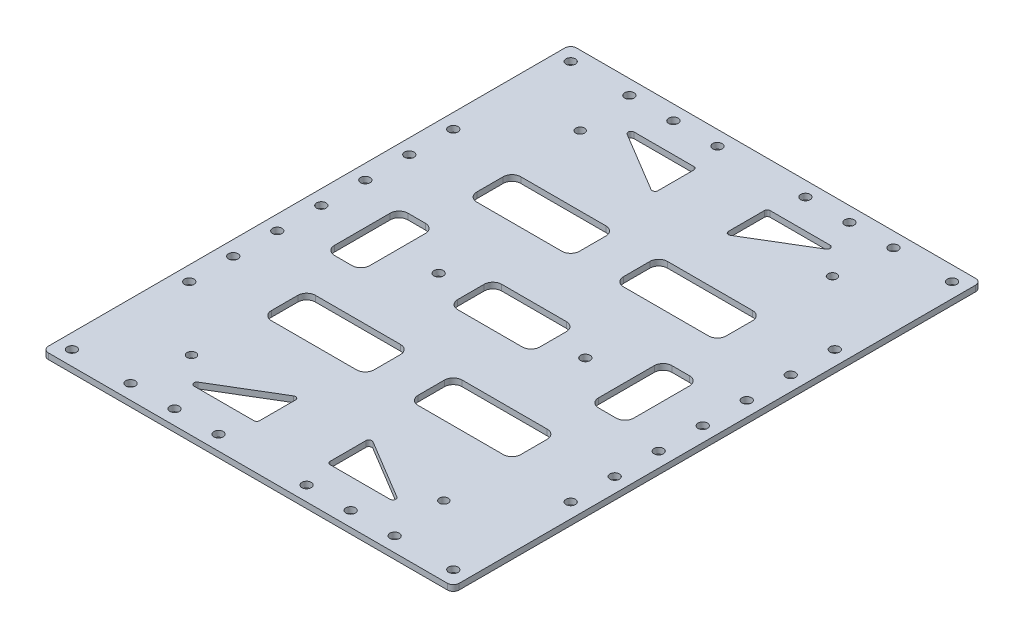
SolidWorks part; units mm, degrees
ref_plane "前视基准面" through (0, 0, 0) normal (0, 0, 1) x (1, 0, 0)
ref_plane "上视基准面" through (0, 0, 0) normal (0, 1, 0) x (1, 0, 0)
ref_plane "右视基准面" through (0, 0, 0) normal (1, 0, 0) x (0, 0, -1)
other "Configuration Table"
sketch "草图1" plane through (0, 0, 0) normal (0, 1, 0) x (1, 0, 0)
  line L1 (-90, -90) -> (90, -90)
  line L2 (-90, -90) -> (-90, 90)
  line L3 (-90, 90) -> (90, 90)
  line L4 (90, -90) -> (90, 90)
  line L5 (-90, -90) -> (90, 90) construction
  line L6 (-90, 90) -> (90, -90) construction
  point P0 (0, 0)
  dimension "D1" = 180
  dimension "D2" = 180
extrude "凸台-拉伸1" add sketch "草图1" along normal blind 2
sketch "草图2" plane through (0, 2, 0) normal (0, 1, 0) x (1, 0, 0)
  line L1 (-42.9895, -66.2305) -> (42.9895, -66.2305) construction
  line L2 (-42.9895, -66.2305) -> (-42.9895, 66.2305) construction
  line L3 (-42.9895, 66.2305) -> (42.9895, 66.2305) construction
  line L4 (42.9895, -66.2305) -> (42.9895, 66.2305) construction
  line L5 (-42.9895, -66.2305) -> (42.9895, 66.2305) construction
  line L6 (-42.9895, 66.2305) -> (42.9895, -66.2305) construction
  circle A0 centre (-42.9895, 66.2305) radius 1.5
  circle A1 centre (42.9895, 66.2305) radius 1.5
  circle A2 centre (-42.9895, -66.2305) radius 1.5
  circle A3 centre (42.9895, -66.2305) radius 1.5
  point P0 (0, 0)
  dimension "D3" = 3
  dimension "D1" = 132.461
  dimension "D2" = 85.979
extrude "切除-拉伸1" cut sketch "草图2" against normal blind 3
sketch "草图3" plane through (0, 2, 0) normal (0, 1, 0) x (1, 0, 0)
  line L0 (-90, 0) -> (90, 0) construction
  line L1 (-14, -7.5) -> (14, -7.5)
  line L2 (-14, -7.5) -> (-14, 7.5)
  line L3 (-14, 7.5) -> (14, 7.5)
  line L4 (14, -7.5) -> (14, 7.5)
  line L5 (-14, -7.5) -> (14, 7.5) construction
  line L6 (-14, 7.5) -> (14, -7.5) construction
  line L7 (-90, 90) -> (-90, -90) construction
  line L8 (90, -90) -> (90, 90) construction
  line L9 (0, 90) -> (0, -90) construction
  line L10 (90, 90) -> (-90, 90) construction
  line L11 (-90, -90) -> (90, -90) construction
  line L12 (-25, 35) -> (0, 35) construction
  line L13 (-42.5, 27.5) -> (-7.5, 27.5)
  line L14 (-42.5, 27.5) -> (-42.5, 42.5)
  line L15 (-42.5, 42.5) -> (-7.5, 42.5)
  line L16 (-7.5, 27.5) -> (-7.5, 42.5)
  line L17 (-42.5, 27.5) -> (-7.5, 42.5) construction
  line L18 (-42.5, 42.5) -> (-7.5, 27.5) construction
  line L23 (42.5, 42.5) -> (7.5, 42.5)
  line L24 (7.5, 27.5) -> (7.5, 42.5)
  line L25 (-25, 35) -> (-25, 0) construction
  line L26 (42.5, 27.5) -> (7.5, 27.5)
  line L27 (42.5, 27.5) -> (42.5, 42.5)
  line L28 (51, 12.5) -> (39, 12.5)
  line L29 (-51, -12.5) -> (-39, -12.5)
  line L30 (-51, -12.5) -> (-51, 12.5)
  line L31 (-51, 12.5) -> (-39, 12.5)
  line L32 (-39, -12.5) -> (-39, 12.5)
  line L33 (-51, -12.5) -> (-39, 12.5) construction
  line L34 (-51, 12.5) -> (-39, -12.5) construction
  line L35 (51, -12.5) -> (39, -12.5)
  line L36 (51, -12.5) -> (51, 12.5)
  line L37 (39, -12.5) -> (39, 12.5)
  line L38 (-42.5, -42.5) -> (-7.5, -42.5)
  line L39 (-7.5, -27.5) -> (-7.5, -42.5)
  line L40 (-42.5, -27.5) -> (-7.5, -27.5)
  line L41 (-42.5, -27.5) -> (-42.5, -42.5)
  line L42 (42.5, -27.5) -> (42.5, -42.5)
  line L43 (42.5, -27.5) -> (7.5, -27.5)
  line L44 (7.5, -27.5) -> (7.5, -42.5)
  line L45 (42.5, -42.5) -> (7.5, -42.5)
  line L51 (-37, 75) -> (-12, 75)
  line L52 (-12, 75) -> (-12, 60)
  line L56 (-12, 60) -> (-37, 75)
  line L57 (12, 75) -> (12, 60)
  line L58 (37, 75) -> (12, 75)
  line L59 (12, 60) -> (37, 75)
  line L60 (37, -75) -> (12, -75)
  line L61 (12, -60) -> (37, -75)
  line L62 (12, -75) -> (12, -60)
  line L63 (-12, -75) -> (-12, -60)
  line L64 (-37, -75) -> (-12, -75)
  line L65 (-12, -60) -> (-37, -75)
  point P0 (0, 0)
  point P18 (-25, 35)
  point P27 (-45, 0)
  dimension "D1" = 28
  dimension "D2" = 15
  dimension "D3" = 35
  dimension "D4" = 25
  dimension "D5" = 35
  dimension "D6" = 15
  dimension "D7" = 45
  dimension "D8" = 12
  dimension "D9" = 25
  dimension "D10" = 15
  dimension "D11" = 15
  dimension "D12" = 12
  dimension "D13" = 25
extrude "切除-拉伸2" cut sketch "草图3" against normal blind 3
fillet "圆角1" radius 3 4 edges at (-14, 1, 7.5) (14, 1, 7.5) (14, 1, -7.5) (-14, 1, -7.5)
sketch "草图5" plane through (0, 2, 0) normal (0, 1, 0) x (1, 0, 0)
  line L0 (80, 90) -> (90, 80)
  line L1 (-77.5, -77.5) -> (77.5, -77.5) construction
  line L2 (-77.5, -77.5) -> (-77.5, 77.5) construction
  line L3 (-77.5, 77.5) -> (77.5, 77.5) construction
  line L4 (77.5, -77.5) -> (77.5, 77.5) construction
  line L5 (-77.5, -77.5) -> (77.5, 77.5) construction
  line L6 (-77.5, 77.5) -> (77.5, -77.5) construction
  line L7 (69.0147, 77.5) -> (77.5, 69.0147) construction
  line L8 (69.0147, 77.5) -> (77.5, 85.9853) construction
  line L9 (77.5, 85.9853) -> (85.9853, 77.5) construction
  line L10 (77.5, 69.0147) -> (85.9853, 77.5) construction
  line L11 (69.0147, 77.5) -> (85.9853, 77.5) construction
  line L12 (77.5, 85.9853) -> (77.5, 69.0147) construction
  line L13 (90, 90) -> (-90, 90) construction
  line L14 (90, -90) -> (90, 90) construction
  line L24 (90, 80) -> (90, 90)
  line L25 (90, 90) -> (80, 90)
  line L26 (0, 90) -> (0, -90) construction
  line L27 (-90, -90) -> (90, -90) construction
  line L28 (90, 0) -> (-90, 0) construction
  line L29 (-90, 90) -> (-90, -90) construction
  line L30 (-77.5, 85.9853) -> (-77.5, 69.0147) construction
  line L31 (-69.0147, 77.5) -> (-85.9853, 77.5) construction
  line L32 (-77.5, 69.0147) -> (-85.9853, 77.5) construction
  line L33 (-77.5, 85.9853) -> (-85.9853, 77.5) construction
  line L34 (-69.0147, 77.5) -> (-77.5, 85.9853) construction
  line L35 (-69.0147, 77.5) -> (-77.5, 69.0147) construction
  line L36 (-90, 90) -> (-80, 90)
  line L37 (-90, 80) -> (-90, 90)
  line L38 (-80, 90) -> (-90, 80)
  line L39 (-69.0147, -77.5) -> (-77.5, -69.0147) construction
  line L40 (-69.0147, -77.5) -> (-77.5, -85.9853) construction
  line L41 (-77.5, -85.9853) -> (-85.9853, -77.5) construction
  line L42 (-77.5, -69.0147) -> (-85.9853, -77.5) construction
  line L43 (-69.0147, -77.5) -> (-85.9853, -77.5) construction
  line L44 (-77.5, -85.9853) -> (-77.5, -69.0147) construction
  line L45 (77.5, -85.9853) -> (77.5, -69.0147) construction
  line L46 (69.0147, -77.5) -> (85.9853, -77.5) construction
  line L47 (77.5, -69.0147) -> (85.9853, -77.5) construction
  line L48 (77.5, -85.9853) -> (85.9853, -77.5) construction
  line L49 (69.0147, -77.5) -> (77.5, -85.9853) construction
  line L50 (69.0147, -77.5) -> (77.5, -69.0147) construction
  line L51 (-80, -90) -> (-90, -80)
  line L52 (-90, -80) -> (-90, -90)
  line L53 (-90, -90) -> (-80, -90)
  line L54 (90, -90) -> (80, -90)
  line L55 (90, -80) -> (90, -90)
  line L56 (80, -90) -> (90, -80)
  circle A0 centre (69.0147, 77.5) radius 1.7 construction
  circle A1 centre (77.5, 69.0147) radius 1.7
  circle A2 centre (77.5, 85.9853) radius 1.7
  circle A3 centre (85.9853, 77.5) radius 1.7
  circle A4 centre (-85.9853, 77.5) radius 1.7
  circle A5 centre (-77.5, 85.9853) radius 1.7
  circle A6 centre (-77.5, 69.0147) radius 1.7 construction
  circle A7 centre (-69.0147, 77.5) radius 1.7 construction
  circle A8 centre (-69.0147, -77.5) radius 1.7 construction
  circle A9 centre (-77.5, -69.0147) radius 1.7 construction
  circle A10 centre (-77.5, -85.9853) radius 1.7
  circle A11 centre (-85.9853, -77.5) radius 1.7
  circle A12 centre (85.9853, -77.5) radius 1.7
  circle A13 centre (77.5, -85.9853) radius 1.7
  circle A14 centre (77.5, -69.0147) radius 1.7 construction
  circle A15 centre (69.0147, -77.5) radius 1.7 construction
  point P0 (0, 0)
  dimension "D3" = 3.4
  dimension "D1" = 12
  dimension "D2" = 12
  dimension "D4" = 155
  dimension "D5" = 10
  dimension "D6" = 10
extrude "切除-拉伸3" cut sketch "草图5" against normal through all
sketch "草图6" plane through (0, 2, 0) normal (0, 1, 0) x (1, 0, 0)
  line L0 (90, 70) -> (70, 50)
  line L1 (90, -80) -> (90, 80) construction
  line L2 (70, 50) -> (70, -50)
  line L3 (70, -50) -> (90, -70)
  line L4 (90, -70) -> (90, 70)
  line L5 (-90, 0) -> (90, 0) construction
  line L6 (-90, 80) -> (-90, -80) construction
  line L7 (0, 90) -> (0, -90) construction
  line L8 (80, 90) -> (-80, 90) construction
  line L9 (-80, -90) -> (80, -90) construction
  line L10 (-70, -50) -> (-90, -70)
  line L11 (-70, 50) -> (-70, -50)
  line L12 (-90, 70) -> (-70, 50)
  line L13 (-90, -70) -> (-90, 70)
  dimension "D1" = 140
  dimension "D2" = 20
  dimension "D3" = 20
  dimension "D4" = 20
extrude "切除-拉伸4" cut sketch "草图6" against normal blind 10
sketch "草图7" plane through (0, 0, 0) normal (0, -1, 0) x (1, 0, 0)
  line L0 (-70, 0) -> (70, 0) construction
  line L1 (-70, -50) -> (-70, 50) construction
  line L2 (70, 50) -> (70, -50) construction
  line L3 (0, 90) -> (0, -90) construction
  line L4 (-80, 90) -> (80, 90) construction
  line L5 (80, -90) -> (-80, -90) construction
  line L6 (-65, -15) -> (-65, 15) construction
  line L7 (-65, 15) -> (-65, 30) construction
  line L8 (-65, 30) -> (-65, 45) construction
  line L9 (0, 85) -> (-15, 85) construction
  line L10 (-15, 85) -> (-30, 85) construction
  line L11 (-30, 85) -> (-45, 85) construction
  line L12 (30, 85) -> (45, 85) construction
  line L13 (15, 85) -> (30, 85) construction
  line L14 (-65, -30) -> (-65, -45) construction
  line L15 (-65, -15) -> (-65, -30) construction
  line L16 (65, -15) -> (65, -30) construction
  line L17 (65, -30) -> (65, -45) construction
  line L18 (65, 30) -> (65, 45) construction
  line L19 (65, 15) -> (65, 30) construction
  line L20 (65, -15) -> (65, 15) construction
  line L21 (15, -85) -> (30, -85) construction
  line L22 (30, -85) -> (45, -85) construction
  line L23 (-30, -85) -> (-45, -85) construction
  line L24 (-15, -85) -> (-30, -85) construction
  line L25 (0, -85) -> (-15, -85) construction
  circle A0 centre (-65, 30) radius 1.6
  circle A1 centre (-65, 15) radius 1.6
  circle A2 centre (-65, 45) radius 1.6
  circle A3 centre (-45, 85) radius 1.6
  circle A4 centre (-30, 85) radius 1.6
  circle A5 centre (-15, 85) radius 1.6
  circle A6 centre (15, 85) radius 1.6
  circle A7 centre (30, 85) radius 1.6
  circle A8 centre (45, 85) radius 1.6
  circle A9 centre (-65, -45) radius 1.6
  circle A10 centre (-65, -15) radius 1.6
  circle A11 centre (-65, -30) radius 1.6
  circle A12 centre (65, -30) radius 1.6
  circle A13 centre (65, -15) radius 1.6
  circle A14 centre (65, -45) radius 1.6
  circle A15 centre (65, 45) radius 1.6
  circle A16 centre (65, 15) radius 1.6
  circle A17 centre (65, 30) radius 1.6
  circle A18 centre (45, -85) radius 1.6
  circle A19 centre (30, -85) radius 1.6
  circle A20 centre (15, -85) radius 1.6
  circle A21 centre (-15, -85) radius 1.6
  circle A22 centre (-30, -85) radius 1.6
  circle A23 centre (-45, -85) radius 1.6
  circle A24 centre (-65, 85) radius 1.6
  circle A25 centre (65, 85) radius 1.6
  circle A26 centre (65, -85) radius 1.6
  circle A27 centre (-65, -85) radius 1.6
  point P36 (-65, 0)
  point P51 (65, 0)
  dimension "D4" = 3.2
  dimension "D6" = 3.2
  dimension "D1" = 15
  dimension "D2" = 15
  dimension "D3" = 15
  dimension "D5" = 5
  dimension "D7" = 15
  dimension "D8" = 15
  dimension "D9" = 15
  dimension "D10" = 5
extrude "切除-拉伸5" cut sketch "草图7" against normal blind 10
fillet "圆角2" radius 3 40 edges at (80, 1, 90) (90, 1, 80) (90, 1, 70) (70, 1, 50) (-80, 1, 90) (-90, 1, 80) (-90, 1, 70) (-70, 1, 50) (-70, 1, -50) (-90, 1, -70) (-90, 1, -80) (-80, 1, -90) (80, 1, -90) (90, 1, -80) (90, 1, -70) (70, 1, -50) (-51, 1, -12.5) (-51, 1, 12.5) (-39, 1, 12.5) (-7.5, 1, -27.5) (-39, 1, -12.5) (-7.5, 1, -42.5) (-42.5, 1, -42.5) (-42.5, 1, -27.5) (-42.5, 1, 27.5) (-42.5, 1, 42.5) (-7.5, 1, 42.5) (-7.5, 1, 27.5) (7.5, 1, -42.5) (7.5, 1, -27.5) (42.5, 1, -27.5) (42.5, 1, -42.5) (7.5, 1, 42.5) (7.5, 1, 27.5) (42.5, 1, 42.5) (42.5, 1, 27.5) (39, 1, 12.5) (39, 1, -12.5) (51, 1, -12.5) (51, 1, 12.5)
fillet "圆角3" radius 1 12 edges at (-37, 1, 75) (-12, 1, 60) (-12, 1, 75) (12, 1, 60) (12, 1, 75) (37, 1, 75) (-37, 1, -75) (-12, 1, -60) (-12, 1, -75) (12, 1, -60) (37, 1, -75) (12, 1, -75)
sketch "草图8" plane through (0, 2, 0) normal (0, 1, 0) x (1, 0, 0)
  line L0 (-78.7574, -90) -> (78.7574, -90) construction
  line L1 (-70, 90) -> (70, 90)
  line L2 (-70, 90) -> (-70, -90)
  line L3 (-70, -90) -> (70, -90)
  line L4 (70, 90) -> (70, -90)
  line L5 (-70, 90) -> (70, -90) construction
  line L6 (-70, -90) -> (70, 90) construction
  line L7 (70, 48.7574) -> (70, -48.7574) construction
  line L8 (-25, 27.5) -> (-25, -27.5) construction
  line L9 (-39.5, 27.5) -> (-10.5, 27.5) construction
  line L10 (-10.5, -27.5) -> (-39.5, -27.5) construction
  line L11 (0, 90) -> (0, 0) construction
  line L12 (-65, 15) -> (-65, -15) construction
  line L24 (-78.7574, -90) -> (78.7574, -90)
  line L25 (80.8787, -89.1213) -> (89.1213, -80.8787)
  line L26 (90, -78.7574) -> (90, -71.2426)
  line L27 (89.1213, -69.1213) -> (70.8787, -50.8787)
  line L28 (70, -48.7574) -> (70, 48.7574)
  line L29 (70.8787, 50.8787) -> (89.1213, 69.1213)
  line L30 (90, 71.2426) -> (90, 78.7574)
  line L31 (89.1213, 80.8787) -> (80.8787, 89.1213)
  line L32 (78.7574, 90) -> (-78.7574, 90)
  line L33 (-80.8787, 89.1213) -> (-89.1213, 80.8787)
  line L34 (-90, 78.7574) -> (-90, 71.2426)
  line L35 (-89.1213, 69.1213) -> (-70.8787, 50.8787)
  line L36 (-70, 48.7574) -> (-70, -48.7574)
  line L37 (-70.8787, -50.8787) -> (-89.1213, -69.1213)
  line L38 (-90, -71.2426) -> (-90, -78.7574)
  line L39 (-89.1213, -80.8787) -> (-80.8787, -89.1213)
  line L40 (-78.7574, -90) -> (78.7574, -90)
  line L41 (80.8787, -89.1213) -> (89.1213, -80.8787)
  line L42 (90, -78.7574) -> (90, -71.2426)
  line L43 (89.1213, -69.1213) -> (70.8787, -50.8787)
  line L44 (70, -48.7574) -> (70, 48.7574)
  line L45 (70.8787, 50.8787) -> (89.1213, 69.1213)
  line L46 (90, 71.2426) -> (90, 78.7574)
  line L47 (89.1213, 80.8787) -> (80.8787, 89.1213)
  line L48 (78.7574, 90) -> (-78.7574, 90)
  line L49 (-80.8787, 89.1213) -> (-89.1213, 80.8787)
  line L50 (-90, 78.7574) -> (-90, 71.2426)
  line L51 (-89.1213, 69.1213) -> (-70.8787, 50.8787)
  line L52 (-70, 48.7574) -> (-70, -48.7574)
  line L53 (-70.8787, -50.8787) -> (-89.1213, -69.1213)
  line L54 (-90, -71.2426) -> (-90, -78.7574)
  line L55 (-89.1213, -80.8787) -> (-80.8787, -89.1213)
  circle A0 centre (-25, 0) radius 1.6
  circle A1 centre (-65, 0) radius 1.6
  circle A2 centre (25, 0) radius 1.6
  circle A3 centre (65, 0) radius 1.6
  arc A16 (78.7574, -90) -> (80.8787, -89.1213) centre (78.7574, -87) ccw
  arc A17 (89.1213, -80.8787) -> (90, -78.7574) centre (87, -78.7574) ccw
  arc A18 (90, -71.2426) -> (89.1213, -69.1213) centre (87, -71.2426) ccw
  arc A19 (70, -48.7574) -> (70.8787, -50.8787) centre (73, -48.7574) ccw
  arc A20 (70.8787, 50.8787) -> (70, 48.7574) centre (73, 48.7574) ccw
  arc A21 (89.1213, 69.1213) -> (90, 71.2426) centre (87, 71.2426) ccw
  arc A22 (90, 78.7574) -> (89.1213, 80.8787) centre (87, 78.7574) ccw
  arc A23 (80.8787, 89.1213) -> (78.7574, 90) centre (78.7574, 87) ccw
  arc A24 (-78.7574, 90) -> (-80.8787, 89.1213) centre (-78.7574, 87) ccw
  arc A25 (-89.1213, 80.8787) -> (-90, 78.7574) centre (-87, 78.7574) ccw
  arc A26 (-90, 71.2426) -> (-89.1213, 69.1213) centre (-87, 71.2426) ccw
  arc A27 (-70, 48.7574) -> (-70.8787, 50.8787) centre (-73, 48.7574) ccw
  arc A28 (-70.8787, -50.8787) -> (-70, -48.7574) centre (-73, -48.7574) ccw
  arc A29 (-89.1213, -69.1213) -> (-90, -71.2426) centre (-87, -71.2426) ccw
  arc A30 (-90, -78.7574) -> (-89.1213, -80.8787) centre (-87, -78.7574) ccw
  arc A31 (-80.8787, -89.1213) -> (-78.7574, -90) centre (-78.7574, -87) ccw
  arc A32 (78.7574, -90) -> (80.8787, -89.1213) centre (78.7574, -87) ccw
  arc A33 (89.1213, -80.8787) -> (90, -78.7574) centre (87, -78.7574) ccw
  arc A34 (90, -71.2426) -> (89.1213, -69.1213) centre (87, -71.2426) ccw
  arc A35 (70, -48.7574) -> (70.8787, -50.8787) centre (73, -48.7574) ccw
  arc A36 (70.8787, 50.8787) -> (70, 48.7574) centre (73, 48.7574) ccw
  arc A37 (89.1213, 69.1213) -> (90, 71.2426) centre (87, 71.2426) ccw
  arc A38 (90, 78.7574) -> (89.1213, 80.8787) centre (87, 78.7574) ccw
  arc A39 (80.8787, 89.1213) -> (78.7574, 90) centre (78.7574, 87) ccw
  arc A40 (-78.7574, 90) -> (-80.8787, 89.1213) centre (-78.7574, 87) ccw
  arc A41 (-89.1213, 80.8787) -> (-90, 78.7574) centre (-87, 78.7574) ccw
  arc A42 (-90, 71.2426) -> (-89.1213, 69.1213) centre (-87, 71.2426) ccw
  arc A43 (-70, 48.7574) -> (-70.8787, 50.8787) centre (-73, 48.7574) ccw
  arc A44 (-70.8787, -50.8787) -> (-70, -48.7574) centre (-73, -48.7574) ccw
  arc A45 (-89.1213, -69.1213) -> (-90, -71.2426) centre (-87, -71.2426) ccw
  arc A46 (-90, -78.7574) -> (-89.1213, -80.8787) centre (-87, -78.7574) ccw
  arc A47 (-80.8787, -89.1213) -> (-78.7574, -90) centre (-78.7574, -87) ccw
  point P0 (0, 0)
  dimension "D2" = 3.2
  dimension "D1" = 0
extrude "切除-拉伸6" cut sketch "草图8" against normal through all both and the other way through all contours A43 L2 L48 A40 L49 A41 L50 A42 L51 | L55 A47 L40 L2 A44 L53 A45 L54 A46 | A35 L4 L40 A32 L41 A33 L42 A34 L43 | L47 A39 L48 L4 A36 L45 A37 L46 A38 | A1 | A0 | A2 | A3
fillet "圆角4" radius 2 4 edges at (-70, 1, 90) (70, 1, 90) (70, 1, -90) (-70, 1, -90)
